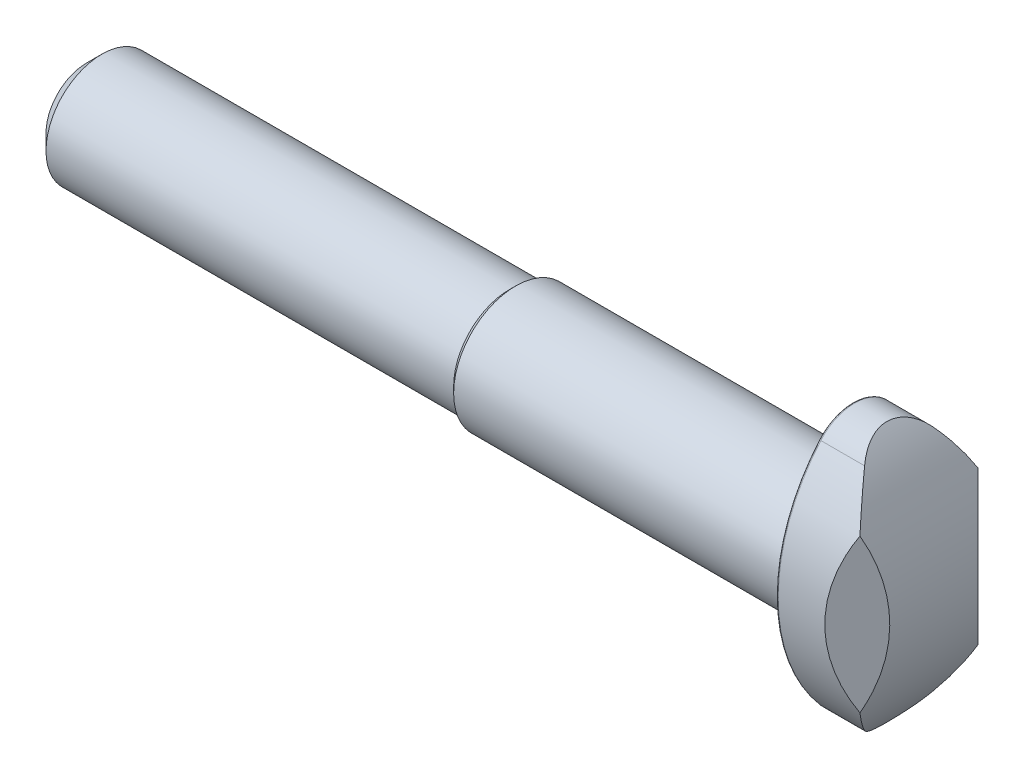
SolidWorks part; units mm, degrees
ref_plane "Front Plane" through (0, 0, 0) normal (0, 0, 1) x (1, 0, 0)
ref_plane "Top Plane" through (0, 0, 0) normal (0, 1, 0) x (1, 0, 0)
ref_plane "Right Plane" through (0, 0, 0) normal (1, 0, 0) x (0, 0, -1)
imported_body "Imported3"
sketch "Sketch1" plane through (1.3445, 0, 0) normal (-1, 0, 0) x (0, 0, 1)
  arc A0 (0, -9.4641) -> (0, 9.4641) centre (6.457, 0) cw
  arc A1 (0, 9.4641) -> (0, -9.4641) centre (-6.457, 0) cw
extrude "Boss-Extrude1" add sketch "Sketch1" along normal blind 1.3445
ref_plane "Plane1" through (0, 0, 0) normal (0, 0, -1) x (-1, 0, 0)
sketch "Sketch2" plane through (0, 0, 0) normal (0, 0, -1) x (-1, 0, 0)
  line L0 (0, 4.045) -> (0, 0)
  line L1 (0, 0) -> (50, 0)
  line L2 (50, 0) -> (50, 3.65)
  line L3 (50, 3.65) -> (22.395, 3.65)
  line L4 (22.395, 3.65) -> (22, 4.045)
  line L5 (22, 4.045) -> (0, 4.045)
  line L6 (0, 0) -> (50, 0) construction
revolve "Revolve1" add sketch "Sketch2" angle 360 about L6
fillet "Fillet1" radius 2.9286 2 edges at (0.6723, -9.4641, 0) (0.6723, 9.4641, 0)
chamfer "Chamfer1" distance 1 angle 45 1 edges at (-50, 0, 3.65)
fillet "Fillet2" radius 0.14 4 edges at (0, 8.5, 0) (0, 0, -5) (0, 0, 5) (0, -8.5, 0)
